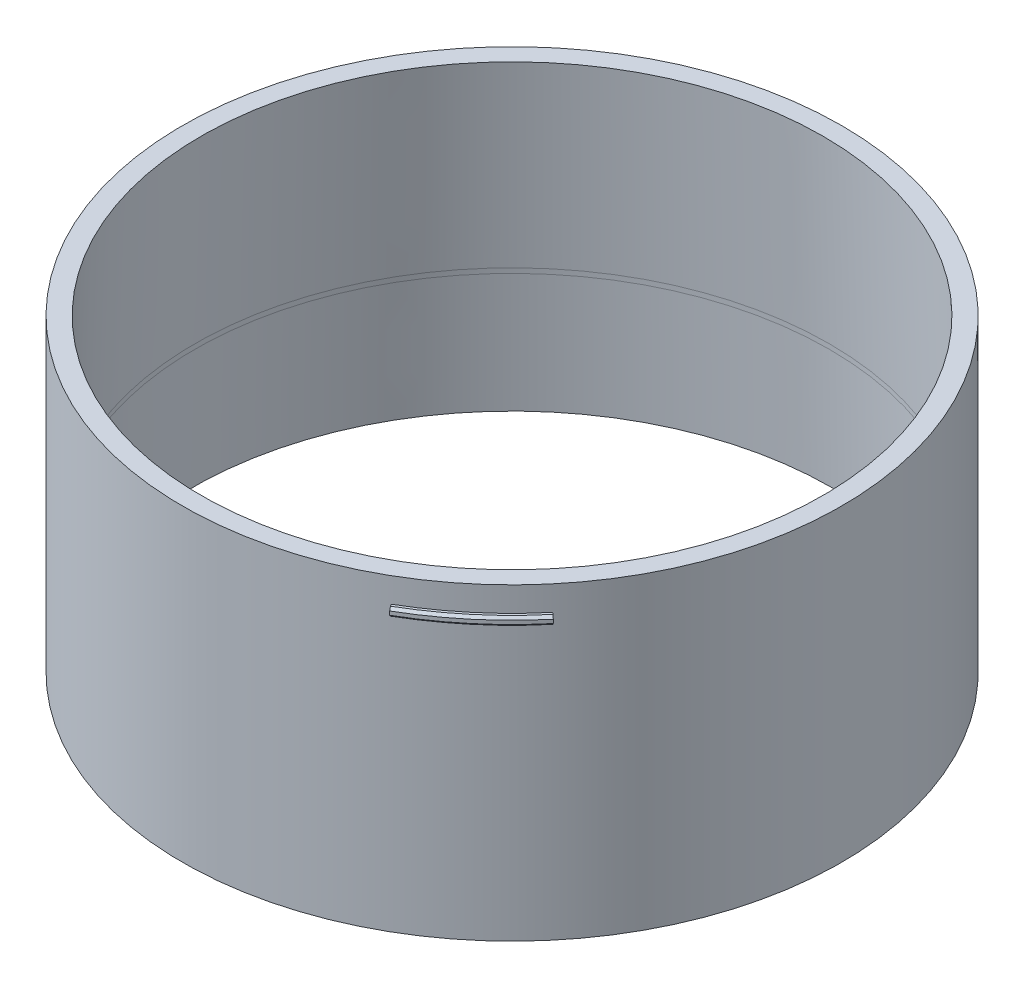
SolidWorks part; units mm, degrees
ref_plane "Płaszczyzna przednia" through (0, 0, 0) normal (0, 0, 1) x (1, 0, 0)
ref_plane "Płaszczyzna górna" through (0, 0, 0) normal (0, 1, 0) x (1, 0, 0)
ref_plane "Płaszczyzna prawa" through (0, 0, 0) normal (1, 0, 0) x (0, 0, -1)
sketch "Szkic1" plane through (0, 0, 0) normal (0, 0, 1) x (1, 0, 0)
  line L0 (0, 0) -> (0, 60) construction
  line L1 (27.5, 0) -> (27.5, 60) construction
  line L2 (26.8, 0) -> (26.8, 60) construction
  line L3 (26.8, 60) -> (27.5, 60) construction
  line L5 (25.2, 60) -> (25.7, 44.998)
  line L7 (25.9, 35) -> (26.7, 35)
  line L9 (-26.8, 0) -> (-26.8, 60) construction
  line L10 (-27.5, 0) -> (-27.5, 60) construction
  line L11 (26.7, 0) -> (26.7, 57) construction
  line L12 (25.9, 35) -> (25.7, 44.998)
  line L13 (0, 35) -> (25.5, 35) construction
  line L14 (25.5, 35) -> (25.5, 34.2508) construction
  line L15 (25.5, 34.2508) -> (0, 34.2508) construction
  line L16 (27.5, 34.8299) -> (26.3, 34.8299) construction
  line L17 (26.3, 34.8299) -> (26.3, 31.8469) construction
  line L20 (26.7, 0) -> (26.7, 60) construction
  line L21 (25.2, 60) -> (26.7, 60)
  line L23 (26.7, 60) -> (26.7, 35)
  dimension "D1" = 27.5
  dimension "D3" = 9.998
  dimension "D4" = 0.8
  dimension "D5" = 25
  dimension "D6" = 0.1
  dimension "D7" = 26.8
  dimension "D8" = 60
  dimension "D9" = 1.5
  dimension "D11" = 25.5
  dimension "D12" = 53.6
  dimension "D2" = 0.7
  dimension "D13" = 25.5
revolve "Obrót1" add sketch "Szkic1" angle 360 about L0
fillet "Zaokrąglenie1" radius 30 1 edges at (0, 44.998, -25.7)
sketch "Szkic2" plane through (0, 0, 0) normal (0, 0, 1) x (1, 0, 0)
  line L0 (-24.6011, 62) -> (-24.6011, 58) construction
  line L8 (0, 54.1623) -> (0, 65.8377) construction
  line L9 (-26.9, 58) -> (-27.1, 57.8)
  line L10 (-26.9, 57.3) -> (-27.1, 57.5)
  line L11 (-27.1, 57.8) -> (-27.1, 57.5)
  line L12 (-26.0159, 57.3) -> (-26.9, 57.3)
  line L15 (26.7, 60) -> (-26.7, 60) construction
  line L16 (-26.9, 58) -> (-26.0159, 58)
  line L18 (-26.0159, 57.3) -> (-26.0159, 58)
  dimension "D1" = 2
  dimension "D2" = 0.2
  dimension "D3" = 0.2
  dimension "D4" = 0.3
  dimension "D5" = 0.2
  dimension "D6" = 0.2
revolve "Obrót2" add sketch "Szkic2" angle 20 about L8
pattern_circular "Szyk kołowy1" count 3 over 360 about axis through (0, 0, 0) along (0, 1, 0) of "Obrót2"
